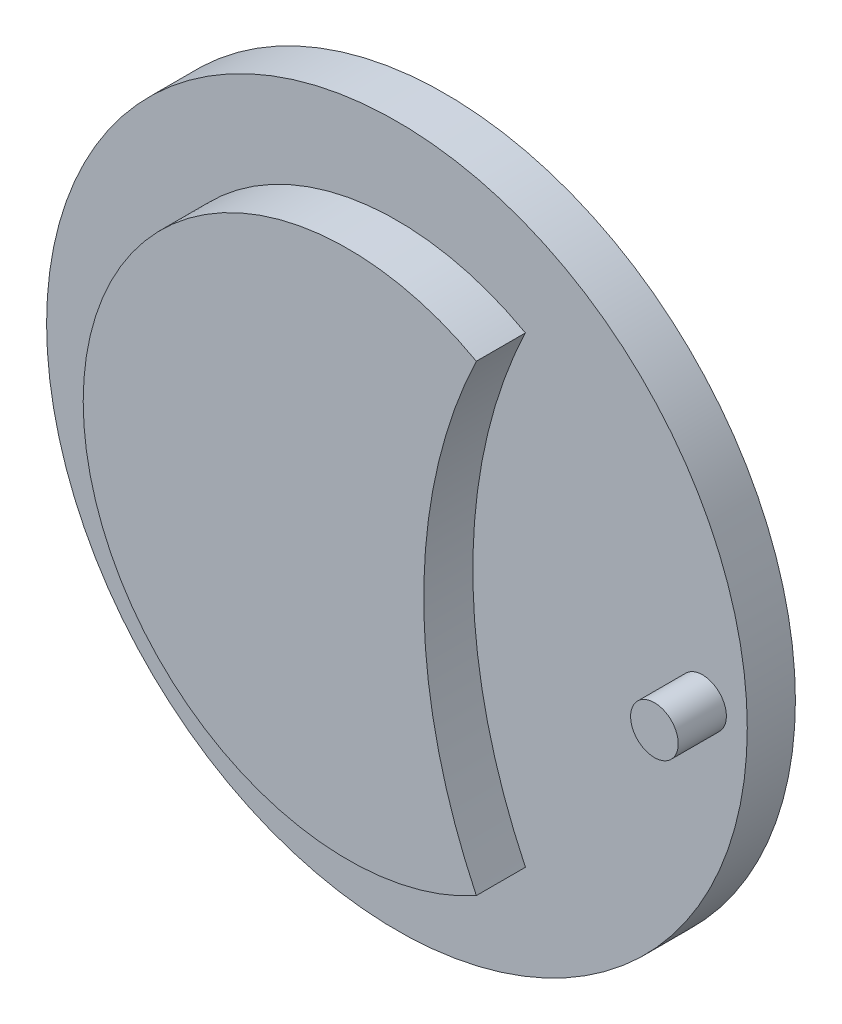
SolidWorks part; units mm, degrees
ref_plane "Front" through (0, 0, 0) normal (0, 0, 1) x (1, 0, 0)
ref_plane "Top" through (0, 0, 0) normal (0, 1, 0) x (1, 0, 0)
ref_plane "Right" through (0, 0, 0) normal (1, 0, 0) x (0, 0, -1)
sketch "Sketch1" plane through (0, 0, 0) normal (0, 0, 1) x (1, 0, 0)
  circle A0 centre (0, 0) radius 69.85
  dimension "D1" = 139.7
extrude "Base-Extrude" add sketch "Sketch1" along normal blind 12.954
sketch "Sketch2" plane through (0, 0, 0) normal (0, 0, -1) x (-1, 0, 0)
  circle A0 centre (0, 0) radius 92.4647
extrude "Boss-Extrude1" add sketch "Sketch2" along normal blind 12.7
sketch "Sketch3" plane through (0, 0, 0) normal (0, 0, 1) x (1, 0, 0)
  circle A0 centre (80.6557, 0) radius 6.2865
  circle A1 centre (0, 0) radius 80.6557 construction
  dimension "D1" = 12.573
  dimension "D2" = 161.3115
extrude "Boss-Extrude2" add sketch "Sketch3" along normal blind 12.7
sketch "Sketch4" plane through (0, 0, 12.954) normal (0, 0, 1) x (1, 0, 0)
  arc A0 (33.9072, 61.0682) -> (33.9072, -61.0682) centre (161.3154, 0) ccw
  circle A1 centre (0, 0) radius 69.85
  arc A2 (33.9072, -61.0682) -> (33.9072, 61.0682) centre (0, 0) ccw
  dimension "D3" = 282.575
  dimension "D2" = 161.3154
  dimension "D1" = 0
extrude "Cut-Extrude1" cut sketch "Sketch4" against normal up to surface (12.954 mm away)
